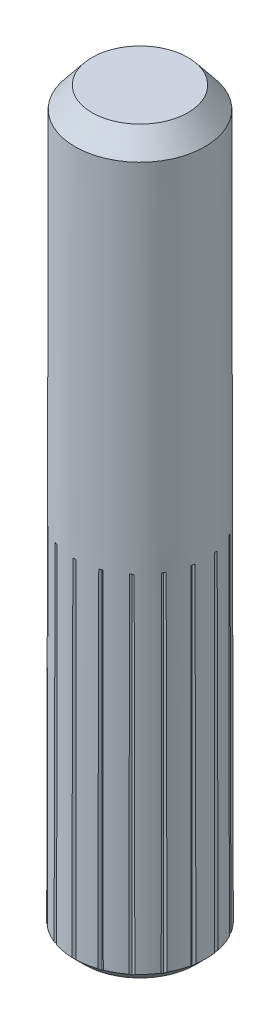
SolidWorks part; units mm, degrees
ref_plane "正面" through (0, 0, 0) normal (0, 0, 1) x (1, 0, 0)
ref_plane "平面" through (0, 0, 0) normal (0, 1, 0) x (1, 0, 0)
ref_plane "右側面" through (0, 0, 0) normal (1, 0, 0) x (0, 0, -1)
sketch "ｽｹｯﾁ1" plane through (0, 0, 0) normal (0, 1, 0) x (1, 0, 0)
  circle A0 centre (0, 0) radius 3.15
extrude "ﾎﾞｽ - 押し出し1" add sketch "ｽｹｯﾁ1" along normal blind 35 draft 0.09
chamfer "面取り1" distance 1 angle 39 1 edges at (0, 35, 3.095)
chamfer "面取り2" distance 0.5 angle 45 1 edges at (0, 0, 3.15)
sketch "ｽｹｯﾁ2" plane through (0, 0, 0) normal (0, -1, 0) x (1, 0, 0)
  line L1 (-0.0012, 3.0453) -> (-0.1034, 3.1475)
  line L2 (-0.0012, 3.0453) -> (0.101, 3.1476)
  circle A1 centre (0, 0) radius 3.1492 construction
  arc A2 (0.101, 3.1476) -> (-0.1034, 3.1475) centre (0, 0) ccw
extrude "ｶｯﾄ - 押し出し1" cut sketch "ｽｹｯﾁ2" against normal blind 17
pattern_circular "円形ﾊﾟﾀｰﾝ1" count 18 every 20 about axis through (0, 0, 0) along (0, 1, 0) of "ｶｯﾄ - 押し出し1"
